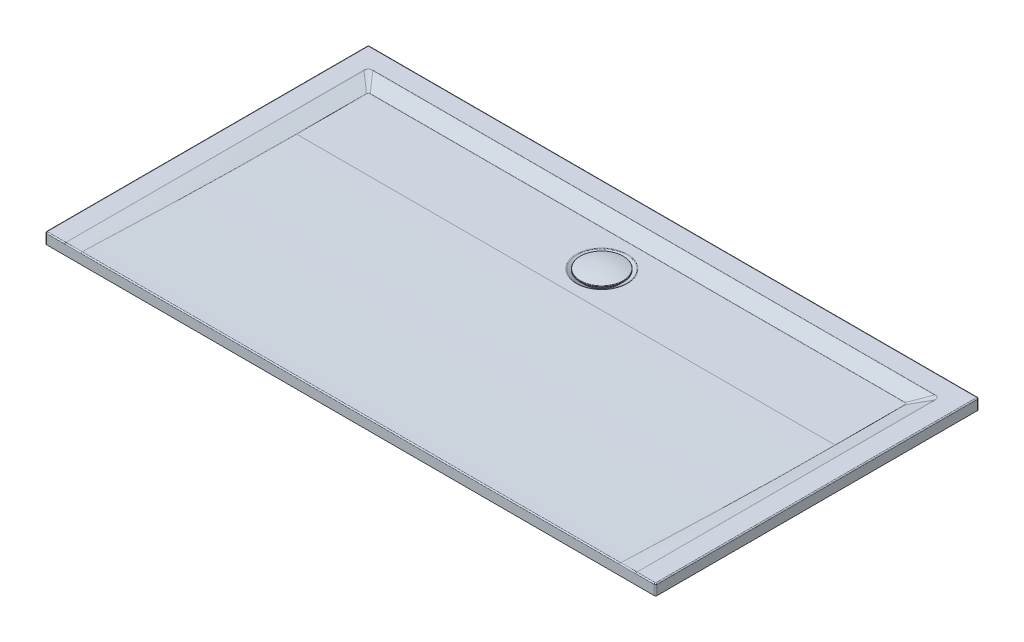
SolidWorks part; units mm, degrees
ref_plane "Płaszczyzna przednia" through (0, 0, 0) normal (0, 0, 1) x (1, 0, 0)
ref_plane "Płaszczyzna górna" through (0, 0, 0) normal (0, 1, 0) x (1, 0, 0)
ref_plane "Płaszczyzna prawa" through (0, 0, 0) normal (1, 0, 0) x (0, 0, -1)
sketch "Szkic1" plane through (0, 0, 0) normal (0, 1, 0) x (1, 0, 0)
  line L0 (0, 450) -> (0, -450) construction
  line L1 (-850, 450) -> (850, 450)
  line L2 (-850, 450) -> (-850, -450)
  line L3 (-850, -450) -> (850, -450)
  line L4 (850, 450) -> (850, -450)
  line L5 (-795, -450) -> (-795, 395)
  line L6 (-795, 395) -> (795, 395)
  line L7 (795, 395) -> (795, -450)
  line L8 (-750, -450) -> (-750, 350)
  line L9 (-750, 350) -> (750, 350)
  line L10 (750, 350) -> (750, -450)
  circle A0 centre (0, 250) radius 45
  circle A1 centre (0, 250) radius 70
  point P9 (0, 395)
  dimension "D6" = 90
  dimension "D7" = 140
  dimension "D1" = 1700
  dimension "D2" = 55
  dimension "D3" = 55
  dimension "D5" = 200
  dimension "D8" = 900
  dimension "D4" = 45
sketch "Szkic2" plane through (0, 0, 0) normal (0, 1, 0) x (1, 0, 0)
  line L0 (-850, -450) -> (850, -450) construction
  line L1 (850, 450) -> (850, -450) construction
  line L2 (795, 395) -> (795, -450) construction
  line L3 (-795, 395) -> (795, 395) construction
  line L4 (-850, 450) -> (850, 450) construction
  line L5 (-795, -450) -> (-795, 395) construction
  line L6 (-850, 450) -> (-850, -450) construction
  line L7 (-850, -450) -> (-795, -450)
  line L8 (850, 450) -> (850, -450)
  line L9 (795, 395) -> (795, -450)
  line L10 (-795, 395) -> (795, 395)
  line L11 (-850, 450) -> (850, 450)
  line L12 (-795, -450) -> (-795, 395)
  line L13 (-850, 450) -> (-850, -450)
  line L14 (795, -450) -> (850, -450)
surface "Powierzchnia-Płaszczyzna1" sketch "Szkic2"
ref_plane "Płaszczyzna1" through (0, -15, 0) normal (0, 1, 0) x (-1, 0, 0)
sketch "Szkic3" plane through (0, -15, 0) normal (0, 1, 0) x (-1, 0, 0)
  line L0 (750, -150) -> (-750, -150)
  line L1 (750, 450) -> (750, -350) construction
  line L2 (-750, -350) -> (-750, 450) construction
  line L3 (0, -150) -> (0, -350) construction
  line L4 (750, -350) -> (-750, -350) construction
  line L5 (-750, -350) -> (-750, -150)
  line L6 (750, -150) -> (750, -350)
  line L7 (750, -350) -> (-750, -350)
  circle A0 centre (0, -250) radius 70 construction
  circle A1 centre (0, -250) radius 70
  point P10 (0, -250)
surface "Powierzchnia-Płaszczyzna2" sketch "Szkic3"
sketch "Szkic4" plane through (0, 0, 0) normal (0, 1, 0) x (1, 0, 0)
  line L0 (750, -450) -> (-750, -450)
other "Granica-Powierzchnia1"
other "Granica-Powierzchnia2"
other "Granica-Powierzchnia3"
mirror "Lustro1" about plane through (0, 0, 0) normal (1, 0, 0)
sketch "Szkic5" plane through (0, 0, 0) normal (0, 1, 0) x (1, 0, 0)
  line L0 (850, 450) -> (850, -450) construction
  line L1 (-850, 450) -> (850, 450) construction
  line L2 (-850, 450) -> (-850, -450) construction
  line L3 (-850, -450) -> (850, -450) construction
  line L4 (850, 450) -> (850, -450)
  line L5 (-850, 450) -> (850, 450)
  line L6 (-850, 450) -> (-850, -450)
  line L7 (-850, -450) -> (850, -450)
surface "Powierzchnia-Wyciągnięcie1" sketch "Szkic5" parameters "D1"=30
sketch "Szkic7" plane through (0, 0, 0) normal (1, 0, 0) x (0, 0, -1)
  line L0 (250, 0) -> (250, -30) construction
  line L1 (450, -30) -> (-450, -30) construction
  line L2 (295, -30) -> (295, -28)
  line L3 (295, -28) -> (299, -28)
  line L6 (299, -28) -> (320, -15)
  dimension "D1" = 90
  dimension "D2" = 2
  dimension "D3" = 98
surface "Powierzchnia-Obrót wokół linii środkowej1" sketch "Szkic7" parameters "D1"=360
surface "Powierzchnia-Płaszczyzna3"
surface "Powierzchnia-Połącz1"
fillet "Zaokrąglenie1" radius 4 6 edges at (0, -28, -299) (0, -15, -180) (850, -15, 450) (850, -15, -450) (-850, -15, -450) (-850, -15, 450)
fillet "Zmienne zaokrąglenie1" radius 40 2 edges at (772.5, -7.5, -372.5)
fillet "Zaokrąglenie3" radius 3 12 edges
fillet "Zaokrąglenie4" radius 3 12 edges at (-848.8284, 0, -448.8284) (0, 0, -450) (848.8284, 0, -448.8284) (850, 0, 0) (848.8284, 0, 448.8284) (820.5, 0, 450) (-820.5, 0, 450) (-848.8284, 0, 448.8284) (-850, 0, 0)
sketch "Szkic8" plane through (0, 0, 0) normal (1, 0, 0) x (0, 0, -1)
  line L0 (250, 0) -> (250, -30) construction
  line L1 (250, -5.6601) -> (179.8469, -5.6601) construction
  line L2 (310, -14.7573) -> (310, -17)
  line L3 (310, -17) -> (250, -17)
  line L4 (250, -17) -> (250, -5.6601)
  line L5 (250, -5.6601) -> (199.9922, 95.6514)
  arc A0 (250, -5.6601) -> (309.2694, -13.7943) centre (250, -225.6601) cw
  arc A1 (309.2694, -13.7943) -> (310, -14.7573) centre (309, -14.7573) cw
  point P11 (310, -14)
  dimension "D1" = 220
  dimension "D4" = 1
  dimension "D2" = 60
  dimension "D3" = 3
  dimension "D5" = 13
revolve "Obrót wokół linii środkowej1" add sketch "Szkic8" angle 360 about L4
